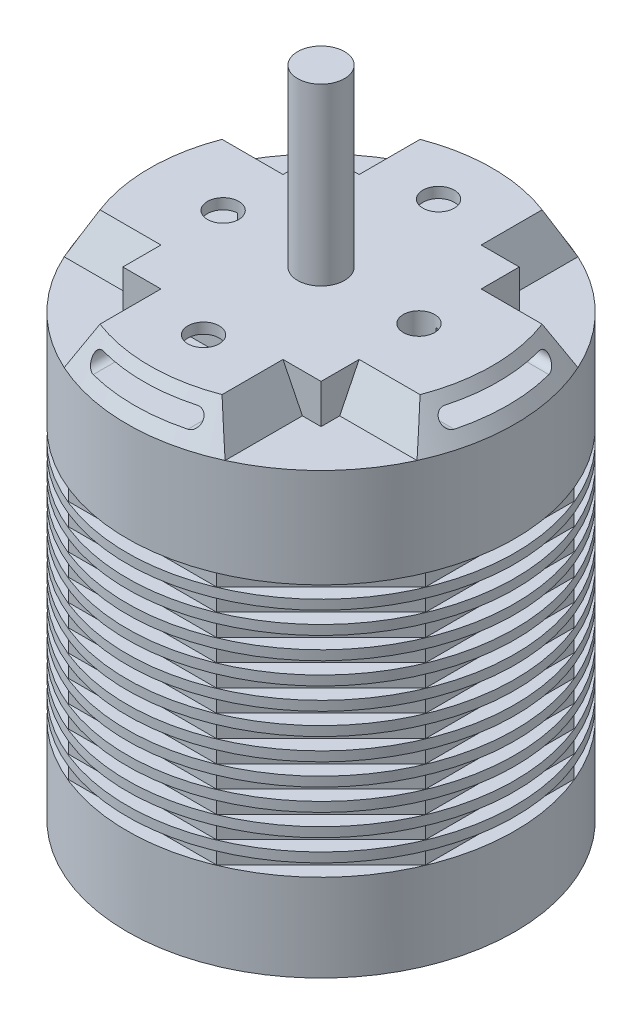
SolidWorks part; units mm, degrees
ref_plane "Front Plane" through (0, 0, 0) normal (0, 0, 1) x (1, 0, 0)
ref_plane "Top Plane" through (0, 0, 0) normal (0, 1, 0) x (1, 0, 0)
ref_plane "Right Plane" through (0, 0, 0) normal (1, 0, 0) x (0, 0, -1)
imported_body "HKIV"
sketch "Sketch1" plane through (0, 102.4, 0) normal (0, 1, 0) x (1, 0, 0)
  circle A0 centre (0, 0) radius 3.7203
extrude "Cut-Extrude1" cut sketch "Sketch1" against normal blind 16.0837
